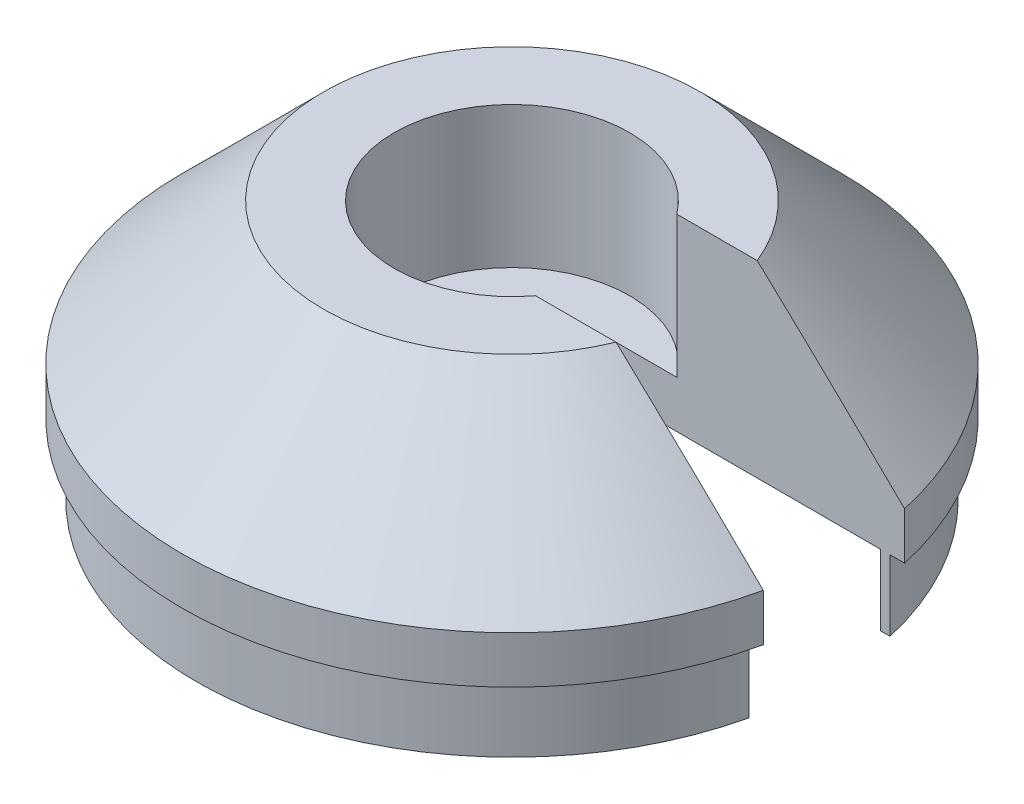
SolidWorks part; units mm, degrees
ref_plane "Front Plane" through (0, 0, 0) normal (0, 0, 1) x (1, 0, 0)
ref_plane "Top Plane" through (0, 0, 0) normal (0, 1, 0) x (1, 0, 0)
ref_plane "Right Plane" through (0, 0, 0) normal (1, 0, 0) x (0, 0, -1)
sketch "Croquis1" plane through (0, 0, 0) normal (0, 0, 1) x (1, 0, 0)
  line L0 (0, 0) -> (1.5, 0) construction
  line L1 (1.5, 0) -> (1.5, 1)
  line L2 (1.5, 1) -> (2.5, 1)
  line L3 (2.5, 1) -> (2.5, 4)
  line L4 (2.5, 4) -> (4, 4)
  line L5 (4, 4) -> (7, 1)
  line L6 (7, 1) -> (7, 0)
  line L7 (7, 0) -> (6.7, 0)
  line L8 (6.7, 0) -> (6.7, -1.5)
  line L9 (6.7, -1.5) -> (6.5, -1.5)
  line L10 (6.5, -1.5) -> (6.5, 0)
  line L11 (6.5, 0) -> (1.5, 0)
  line L12 (0, 0) -> (0, 7.8239) construction
  dimension "D1" = 1.5
  dimension "D2" = 2.5
  dimension "D3" = 1
  dimension "D4" = 3
  dimension "D5" = 4
  dimension "D6" = 7
  dimension "D7" = 1
  dimension "D8" = 1.5
  dimension "D9" = 5
  dimension "D10" = 0.2
revolve "Revolución1" add sketch "Croquis1" angle 360 about L12
sketch "Croquis2" plane through (0, 0, 0) normal (0, 1, 0) x (1, 0, 0)
  line L0 (0, 1.5) -> (7.6426, 1.5)
  line L1 (7.6426, 1.5) -> (7.6426, -1.5)
  line L2 (7.6426, -1.5) -> (0, -1.5)
  line L3 (0, -1.5) -> (0, 1.5)
  circle A0 centre (0, 0) radius 1.5 construction
  point P5 (0, 0)
extrude "Cortar-Extruir1" cut sketch "Croquis2" along normal through all and the other way through all
